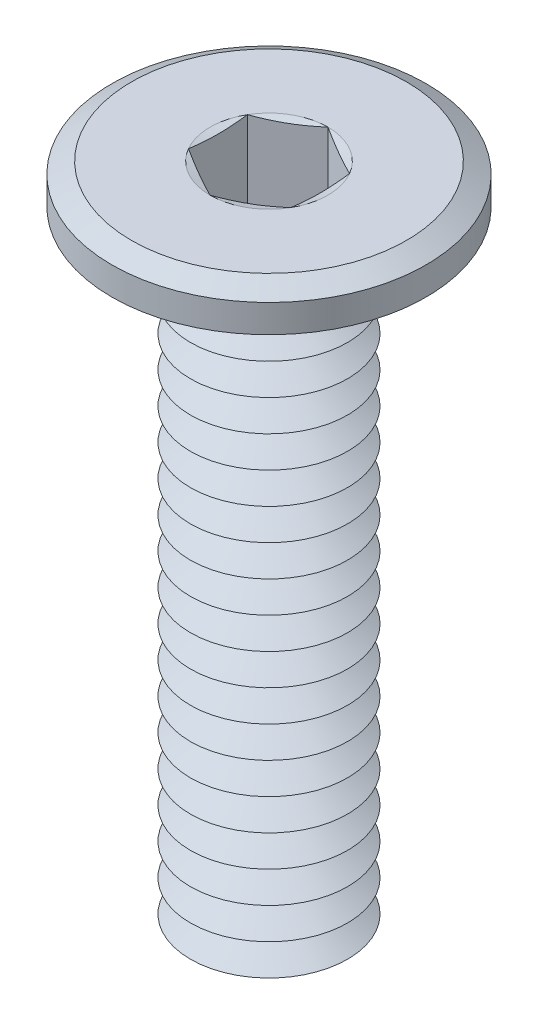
SolidWorks part; units mm, degrees
ref_plane "Front Plane" through (0, 0, 0) normal (0, 0, 1) x (1, 0, 0)
ref_plane "Top Plane" through (0, 0, 0) normal (0, 1, 0) x (1, 0, 0)
ref_plane "Right Plane" through (0, 0, 0) normal (1, 0, 0) x (0, 0, -1)
sketch "Sketch1" plane through (0, 0, 0) normal (0, 1, 0) x (1, 0, 0)
  circle A0 centre (0, 0) radius 2
  dimension "D1" = 4
extrude "Boss-Extrude1" add sketch "Sketch1" against normal blind 0.5
sketch "Sketch2" plane through (0, -0.5, 0) normal (0, -1, 0) x (1, 0, 0)
  circle A0 centre (0, 0) radius 1
  dimension "D1" = 2
extrude "Boss-Extrude2" add sketch "Sketch2" along normal blind 8
sketch "Sketch3" plane through (0, 0, 0) normal (1, 0, 0) x (0, 0, -1)
  line L0 (0, 0.9906) -> (0, -8.2999) construction
sketch "Sketch5" plane through (0, 0, 0) normal (1, 0, 0) x (0, 0, -1)
  line L0 (-1, -8.7) -> (-0.6536, -8.5)
  line L1 (-1, -0.5) -> (-1, -8.5) construction
  line L2 (-0.6536, -8.5) -> (-1, -8.3)
  line L3 (-1, -0.5) -> (-1, -8.5) construction
  line L4 (-1, -8.3) -> (-1, -8.7)
  line L6 (-1, -0.5) -> (-1, -8.5) construction
  line L7 (-1, -0.5) -> (-1, -8.5) construction
  line L14 (-1, -8.5) -> (1, -8.5) construction
  dimension "D1" = 0.4
revolve "Cut-Revolve1" cut sketch "Sketch5" angle 360 about L0
pattern_linear "LPattern1" count 19 spacing 0.4 along (0, 1, 0) of "Cut-Revolve1"
fillet "Fillet1" radius 0.1 1 edges at (0, -0.5, -1)
chamfer "Chamfer2" distance 0.25 angle 30 1 edges at (0, 0, 2)
sketch "Sketch6" plane through (0, 0, 0) normal (0, 1, 0) x (1, 0, 0)
  line L1 (0, 0.7506) -> (-0.65, 0.3753)
  line L2 (-0.65, 0.3753) -> (-0.65, -0.3753)
  line L3 (-0.65, -0.3753) -> (0, -0.7506)
  line L4 (0, -0.7506) -> (0.65, -0.3753)
  line L5 (0.65, -0.3753) -> (0.65, 0.3753)
  line L6 (0.65, 0.3753) -> (0, 0.7506)
  circle A0 centre (0, 0) radius 0.65 construction
  dimension "D1" = 1.3
extrude "Cut-Extrude1" cut sketch "Sketch6" against normal blind 1.2
sketch "Sketch7" plane through (0, -1.2, 0) normal (0, 1, 0) x (1, 0, 0)
  line L0 (-0.65, 0.3753) -> (-0.65, -0.3753) construction
  circle A0 centre (0, 0) radius 0.65
extrude "Cut-Extrude2" cut sketch "Sketch7" against normal through all draft 60
sketch "Sketch8" plane through (0, 0, 0) normal (0, 1, 0) x (1, 0, 0)
  circle A0 centre (0, 0) radius 0.7506
extrude "Cut-Extrude3" cut sketch "Sketch8" against normal through all draft 75
